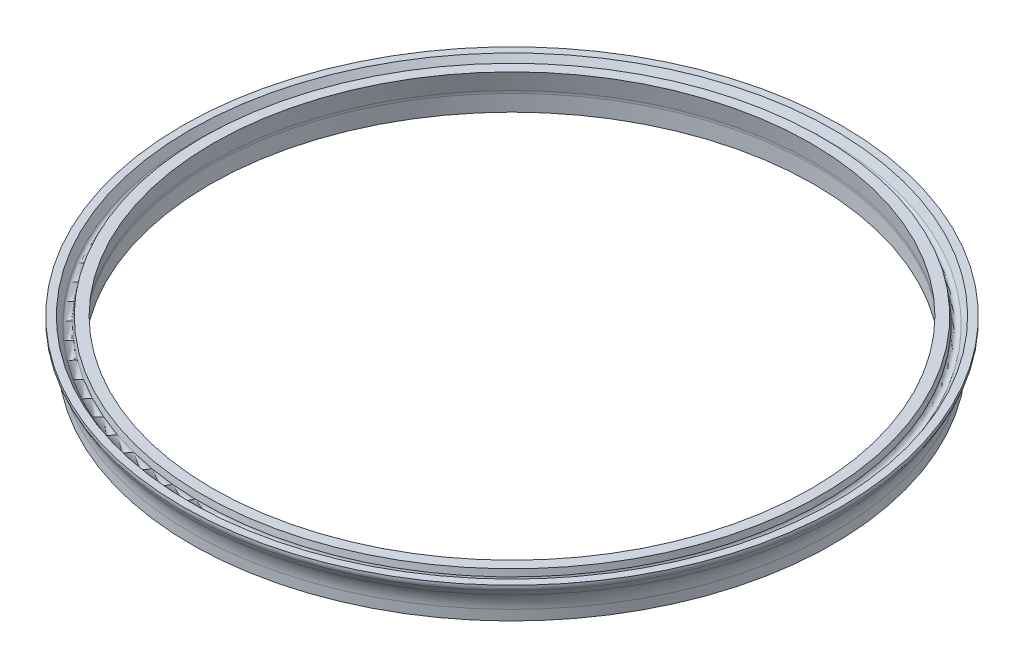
SolidWorks part; units mm, degrees
ref_plane "Plan1" through (0, 0, 0) normal (0, 0, 1) x (1, 0, 0)
ref_plane "Plan2" through (0, 0, 0) normal (0, 1, 0) x (1, 0, 0)
ref_plane "Plan3" through (0, 0, 0) normal (1, 0, 0) x (0, 0, -1)
sketch "Esquisse1" plane through (0, 0, 0) normal (0, 0, 1) x (1, 0, 0)
  line L0 (80.1, 96.925) -> (80.1, 44.775) construction
  line L1 (-3.6, 78) -> (1.2514, 78)
  line L3 (1.2514, 78) -> (1.2514, 82.2565)
  line L4 (-5.9, 87.7) -> (-3.9357, 87.7)
  line L6 (-5.9, 87.7) -> (-5.9, 86.9729)
  line L9 (-5.7614, 86.4649) -> (-4.7091, 84.6806)
  line L10 (-3.9357, 87.7) -> (-2.7588, 85.7044)
  line L11 (-0.9109, 86.0487) -> (-0.6369, 87.7)
  line L12 (-3.6, 80.6167) -> (-3.6, 78)
  line L13 (-0.6369, 87.7) -> (2.1, 87.7)
  line L14 (2.1, 87.7) -> (1.3054, 82.9113)
  arc A0 (-0.9109, 86.0487) -> (-2.7588, 85.7044) centre (-1.8974, 86.2124) cw
  arc A2 (1.3054, 82.9113) -> (1.2514, 82.2565) centre (5.2514, 82.2565) ccw
  arc A3 (-3.6, 80.6167) -> (-4.7091, 84.6806) centre (-11.6, 80.6167) ccw
  arc A4 (-5.7614, 86.4649) -> (-5.9, 86.9729) centre (-4.9, 86.9729) cw
  point P25 (-1.45, 82.8)
  dimension "D2" = 1
  dimension "D3" = 4
  dimension "D5" = 8
  dimension "D6" = 1
  dimension "D7" = 86
  dimension "D8" = 2.2
  dimension "D9" = 156
  dimension "D10" = 2.7
revolve "Révolution1" add sketch "Esquisse1" angle 360 about L0
